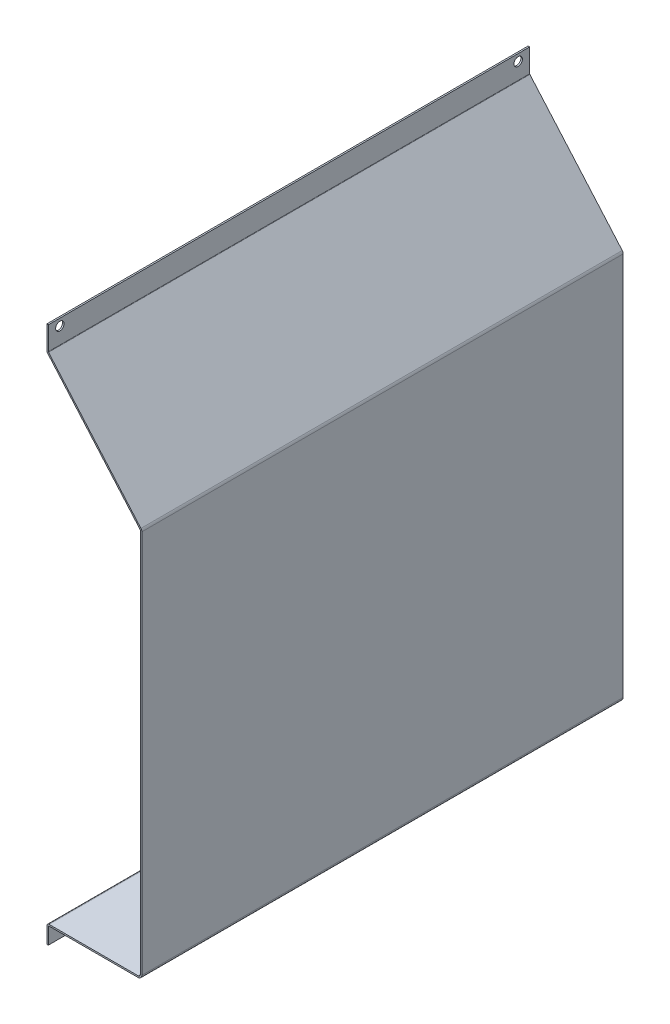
SolidWorks part; units mm, degrees
ref_plane "Face" through (0, 0, 0) normal (0, 0, 1) x (1, 0, 0)
ref_plane "Dessus" through (0, 0, 0) normal (0, 1, 0) x (1, 0, 0)
ref_plane "Droite" through (0, 0, 0) normal (1, 0, 0) x (0, 0, -1)
sketch "Esquisse1" plane through (0, 0, 0) normal (0, 0, 1) x (1, 0, 0)
  line L0 (0, 0) -> (0, 10.5)
  line L1 (1.5, 12) -> (59.5, 12)
  line L2 (61, 13.5) -> (61, 264.0392)
  line L3 (60.6321, 265.0233) -> (0.3679, 334.3492)
  line L4 (0, 335.3333) -> (0, 350.5)
  line L5 (1, 0) -> (1, 10.5)
  line L6 (1.5, 11) -> (59.5, 11)
  line L7 (62, 13.5) -> (62, 264.0392)
  line L8 (61.3868, 265.6793) -> (1.1226, 335.0053)
  line L9 (1, 335.3333) -> (1, 350.5)
  line L10 (0, 350.5) -> (1, 350.5)
  line L11 (1, 0) -> (0, 0)
  arc A0 (0, 10.5) -> (1.5, 12) centre (1.5, 10.5) cw
  arc A1 (59.5, 12) -> (61, 13.5) centre (59.5, 13.5) ccw
  arc A2 (61, 264.0392) -> (60.6321, 265.0233) centre (59.5, 264.0392) ccw
  arc A3 (0.3679, 334.3492) -> (0, 335.3333) centre (1.5, 335.3333) cw
  arc A4 (1, 10.5) -> (1.5, 11) centre (1.5, 10.5) cw
  arc A5 (59.5, 11) -> (62, 13.5) centre (59.5, 13.5) ccw
  arc A6 (62, 264.0392) -> (61.3868, 265.6793) centre (59.5, 264.0392) ccw
  arc A7 (1.1226, 335.0053) -> (1, 335.3333) centre (1.5, 335.3333) cw
  point P9 (0, 12)
  point P14 (61, 264.6)
  dimension "D6" = 1.5
  dimension "D7" = 1.5
  dimension "D8" = 1.5
  dimension "D9" = 1.5
  dimension "D1" = 12
  dimension "D2" = 41
  dimension "D3" = 61
  dimension "D4" = 264.6
  dimension "D5" = 350.5
  dimension "D10" = 1
extrude "Extrusion1" add sketch "Esquisse1" along normal mid plane 314
sketch "Esquisse2" plane through (0, 0, 0) normal (-1, 0, 0) x (0, 0, 1)
  line L0 (0, -6.0718) -> (0, 369.4681) construction
  line L1 (-157, 350.5) -> (-157, 335.3333) construction
  line L2 (157, 350.5) -> (-157, 350.5) construction
  line L3 (157, 0) -> (-157, 0) construction
  circle A0 centre (-149.5, 346) radius 2.75
  circle A1 centre (149.5, 346) radius 2.75
  circle A2 centre (0, 4.5) radius 2.75
  dimension "D1" = 5.5
  dimension "D2" = 7.5
  dimension "D4" = 5.5
  dimension "D3" = 4.5
  dimension "D5" = 4.5
extrude "Enlèv. mat.-Extru.1" cut sketch "Esquisse2" against normal through all
